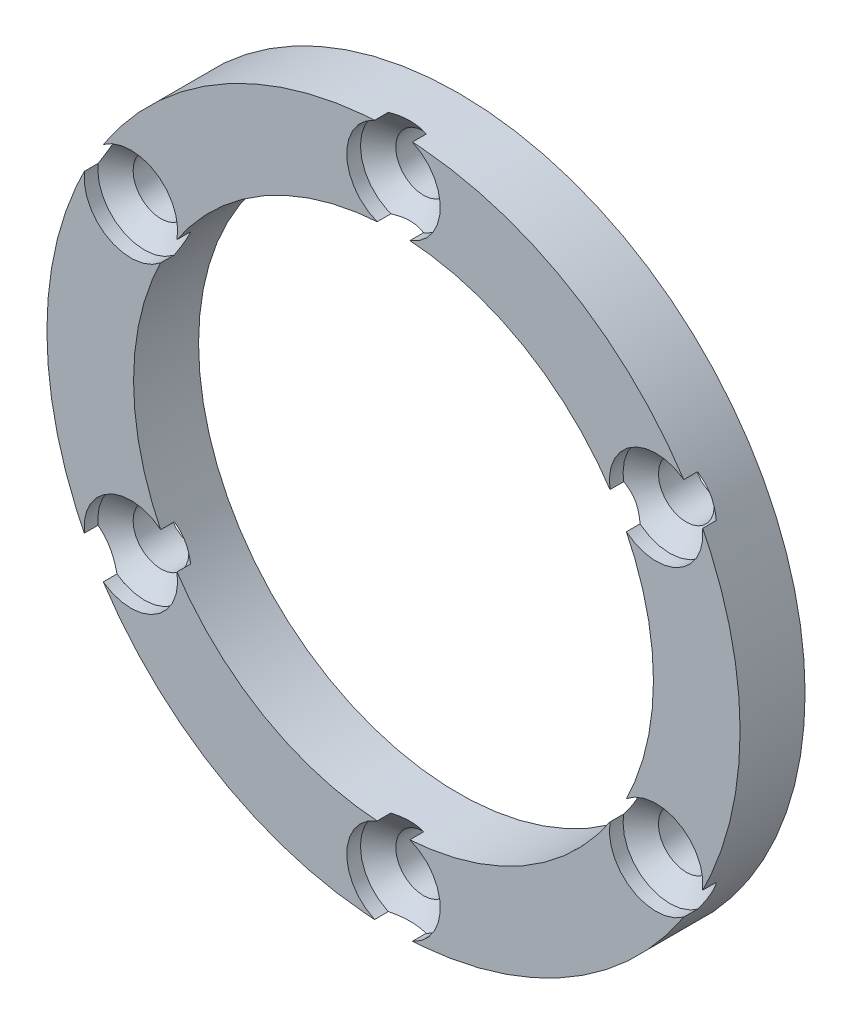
SolidWorks part; units mm, degrees
ref_plane "Front" through (0, 0, 0) normal (0, 0, 1) x (1, 0, 0)
ref_plane "Top" through (0, 0, 0) normal (0, 1, 0) x (1, 0, 0)
ref_plane "Right" through (0, 0, 0) normal (1, 0, 0) x (0, 0, -1)
sketch "Sketch1" plane through (0, 0, 0) normal (0, 0, 1) x (1, 0, 0)
  circle A0 centre (0, 0) radius 25.4
  circle A1 centre (0, 0) radius 19.05
  dimension "D1" = 50.8
  dimension "D2" = 38.1
extrude "Boss-Extrude1" add sketch "Sketch1" along normal blind 4.7625
sketch "Sketch2" plane through (0, 0, 4.7625) normal (0, 0, 1) x (1, 0, 0)
  line L0 (0, 0) -> (0, 22.225) construction
  dimension "D1" = 22.225
hole_wizard "#20 (0.161) Diameter Hole1" positions "Sketch3" profile "Sketch5" hole size "#20" standard "ANSI Inch"
sketch "Sketch3" plane through (0, 0, 4.7625) normal (0, 0, 1) x (1, 0, 0)
  point P0 (0, 22.225)
sketch "Sketch5" plane through (0, 22.225, 4.7625) normal (1, 0, 0) x (0, -1, 0)
  line L0 (0, 0) -> (0, 4.7625)
  line L1 (0, 4.7625) -> (2.0447, 4.7625)
  line L2 (2.0447, 4.7625) -> (2.0447, 0)
  line L5 (2.0447, 0) -> (0, 0)
  line L11 (0, -6.35) -> (0, 107.95) construction
  dimension "Thru Hole Dia." = 4.0894
  dimension "Thru Hole Depth" = 4.7625
chamfer "Chamfer1" distance 2.54 angle 41 1 edges at (2.0447, 22.225, 4.7625)
sketch "Sketch6" plane through (0, 0, 4.7625) normal (0, 0, 1) x (1, 0, 0)
  arc A0 (-1.3841, 25.3623) -> (-1.1985, 19.0123) centre (0, 22.225) ccw
  arc A1 (-5.8395, 24.7196) -> (-5.0457, 18.3696) centre (0, 22.225) ccw
  arc A2 (-3.5272, 25.1539) -> (3.5272, 25.1539) centre (0, 0) ccw construction
  arc A3 (5.8395, 24.7196) -> (1.3841, 25.3623) centre (0, 0) ccw
  arc A4 (-3.0521, 18.8039) -> (3.0521, 18.8039) centre (0, 0) ccw construction
  arc A5 (5.0457, 18.3696) -> (1.1985, 19.0123) centre (0, 0) ccw
  arc A6 (-3.5272, 25.1539) -> (3.5272, 25.1539) centre (0, 0) ccw construction
  arc A7 (5.0457, 18.3696) -> (5.8395, 24.7196) centre (0, 22.225) ccw
  arc A8 (-1.3841, 25.3623) -> (-5.8395, 24.7196) centre (0, 0) ccw
  arc A9 (1.1985, 19.0123) -> (1.3841, 25.3623) centre (0, 22.225) ccw
  arc A10 (-1.1985, 19.0123) -> (-5.0457, 18.3696) centre (0, 0) ccw
  point P7 (-5.797, 18.1486)
  point P11 (5.8023, 18.1448)
  point P13 (-6.7203, 24.4948)
  point P18 (6.7203, 24.4948)
  dimension "D1" = 6.35
  dimension "D2" = 6.858
extrude "Boss-Extrude2" add sketch "Sketch6" against normal up to surface (1.0046 mm away)
pattern_circular "CirPattern1" count 6 over 360 about axis through (0, 0, 0) along (0, 0, 1) of "#20 (0.161) Diameter Hole1", "Chamfer1", "Boss-Extrude2"
